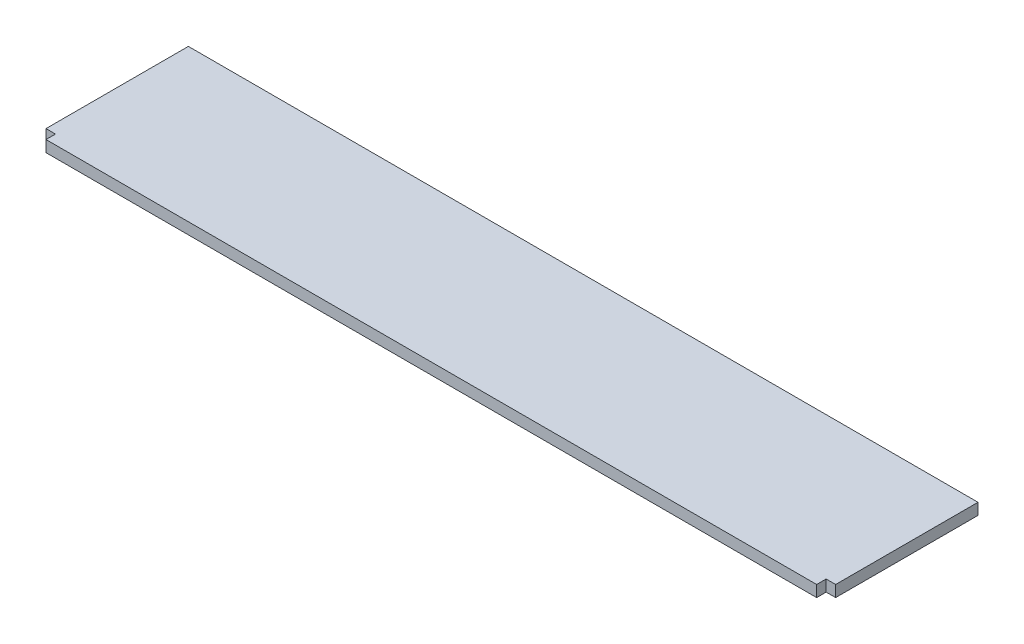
SolidWorks part; units mm, degrees
ref_plane "Plan de face" through (0, 0, 0) normal (0, 0, 1) x (1, 0, 0)
ref_plane "Plan de dessus" through (0, 0, 0) normal (0, 1, 0) x (1, 0, 0)
ref_plane "Plan de droite" through (0, 0, 0) normal (1, 0, 0) x (0, 0, -1)
sketch "Esquisse1" plane through (0, 0, 0) normal (0, 1, 0) x (1, 0, 0)
  line L1 (0, 0) -> (2080, 0)
  line L2 (0, 0) -> (0, 400)
  line L3 (0, 400) -> (2080, 400)
  line L4 (2080, 0) -> (2080, 400)
  dimension "D1" = 2080
  dimension "D2" = 400
extrude "Boss.-Extru.1" add sketch "Esquisse1" along normal blind 30
sketch "Esquisse2" plane through (0, 30, 0) normal (0, 1, 0) x (1, 0, 0)
  line L1 (2080, 0) -> (2055, 0)
  line L2 (2080, 0) -> (2080, 25)
  line L3 (2080, 25) -> (2055, 25)
  line L4 (2055, 0) -> (2055, 25)
  line L5 (0, 0) -> (25, 0)
  line L6 (0, 0) -> (0, 25)
  line L7 (0, 25) -> (25, 25)
  line L8 (25, 0) -> (25, 25)
  dimension "D1" = 25
  dimension "D2" = 25
  dimension "D3" = 25
  dimension "D4" = 25
extrude "Enlèv. mat.-Extru.1" cut sketch "Esquisse2" against normal through all
